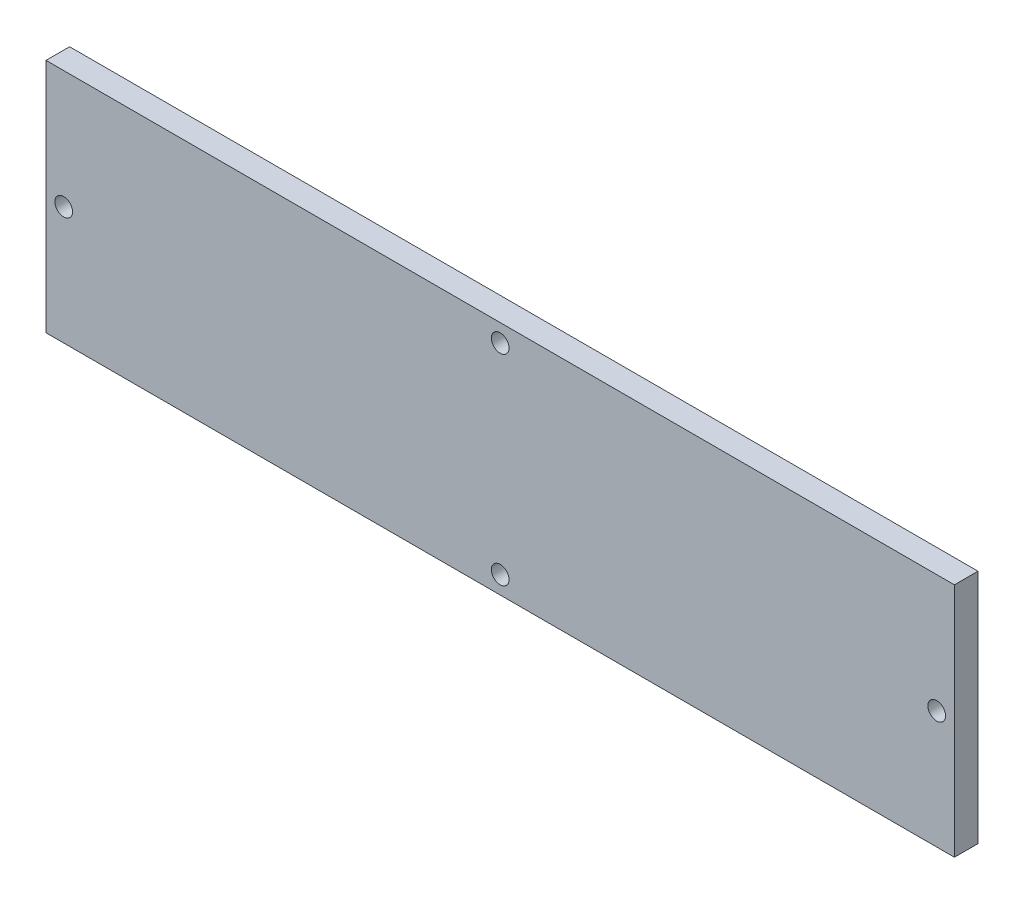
SolidWorks part; units mm, degrees
ref_plane "Face" through (0, 0, 0) normal (0, 0, 1) x (1, 0, 0)
ref_plane "Dessus" through (0, 0, 0) normal (0, 1, 0) x (1, 0, 0)
ref_plane "Droite" through (0, 0, 0) normal (1, 0, 0) x (0, 0, -1)
sketch "Esquisse1" plane through (0, 0, 0) normal (0, 0, 1) x (1, 0, 0)
  line L1 (-63.1675, 31.0913) -> (90.8325, 31.0913)
  line L2 (-63.1675, 31.0913) -> (-63.1675, -8.9087)
  line L3 (-63.1675, -8.9087) -> (90.8325, -8.9087)
  line L4 (90.8325, 31.0913) -> (90.8325, -8.9087)
  dimension "D1" = 154
  dimension "D2" = 40
extrude "Base-Extrusion" add sketch "Esquisse1" along normal blind 6
sketch "Esquisse3" plane through (0, 0, 0) normal (0, 0, -1) x (-1, 0, 0)
  line L1 (-90.8325, 31.0913) -> (63.1675, 31.0913)
  line L2 (-90.8325, 31.0913) -> (-90.8325, -8.9087)
  line L3 (-90.8325, -8.9087) -> (63.1675, -8.9087)
  line L4 (63.1675, 31.0913) -> (63.1675, -8.9087)
  line L5 (-84.8325, 25.0913) -> (57.1675, 25.0913)
  line L6 (-84.8325, 25.0913) -> (-84.8325, -2.9087)
  line L7 (-84.8325, -2.9087) -> (57.1675, -2.9087)
  line L8 (57.1675, 25.0913) -> (57.1675, -2.9087)
  dimension "D1" = 154
  dimension "D2" = 40
  dimension "D3" = 6
  dimension "D4" = 6
  dimension "D5" = 6
  dimension "D6" = 6
extrude "Enlèv. mat.-Extru.1" cut sketch "Esquisse3" against normal blind 2
sketch "Esquisse4" plane through (0, 0, 6) normal (0, 0, 1) x (1, 0, 0)
  line L0 (-63.1675, -8.9087) -> (90.8325, -8.9087) construction
  line L1 (90.8325, 31.0913) -> (-63.1675, 31.0913) construction
  line L2 (90.8325, -8.9087) -> (90.8325, 31.0913) construction
  line L3 (-63.1675, 31.0913) -> (-63.1675, -8.9087) construction
  circle A0 centre (13.8325, -5.9087) radius 1.5
  circle A1 centre (87.8325, 11.0913) radius 1.5
  circle A2 centre (13.8325, 28.0913) radius 1.5
  circle A3 centre (-60.1675, 11.0913) radius 1.5
  dimension "D9" = 3
  dimension "D10" = 3
  dimension "D11" = 3
  dimension "D12" = 3
  dimension "D1" = 20
  dimension "D2" = 3
  dimension "D3" = 3
  dimension "D4" = 20
  dimension "D5" = 77
  dimension "D6" = 3
  dimension "D7" = 77
  dimension "D8" = 3
extrude "Enlèv. mat.-Extru.2" cut sketch "Esquisse4" against normal up to vertex (4 mm away)
